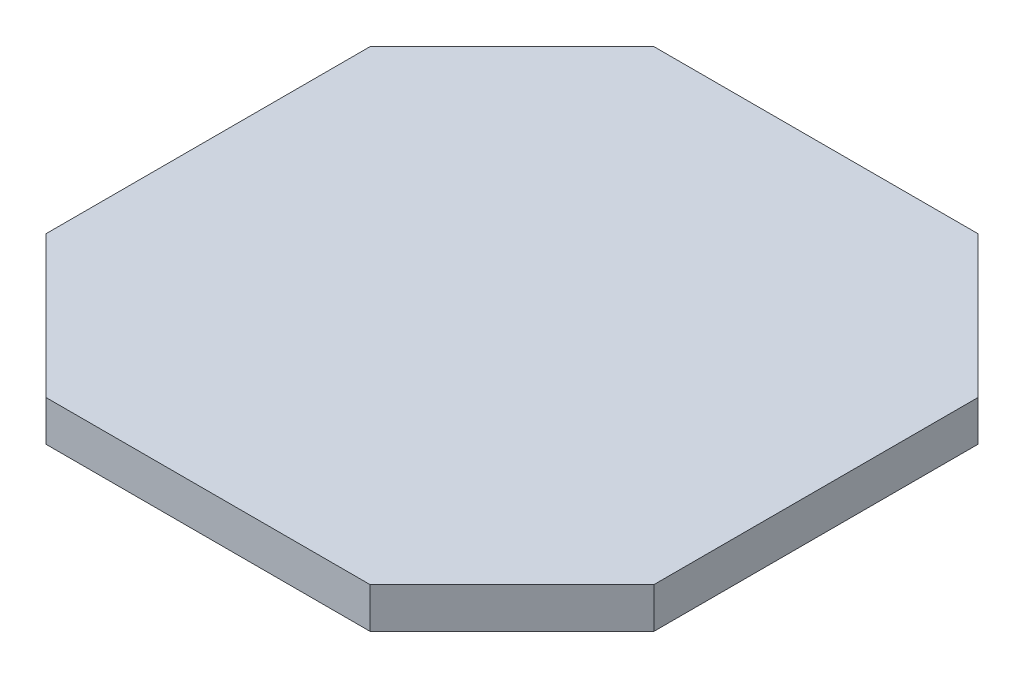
SolidWorks part; units mm, degrees
ref_plane "Front Plane" through (0, 0, 0) normal (0, 0, 1) x (1, 0, 0)
ref_plane "Top Plane" through (0, 0, 0) normal (0, 1, 0) x (1, 0, 0)
ref_plane "Right Plane" through (0, 0, 0) normal (1, 0, 0) x (0, 0, -1)
sketch "Sketch1" plane through (0, 0, 0) normal (0, 1, 0) x (1, 0, 0)
  line L0 (0, 0) -> (0, 19.05) construction
  line L1 (10.16, -19.05) -> (19.05, -10.16)
  line L2 (19.05, 0) -> (19.05, -10.16)
  line L3 (10.16, 19.05) -> (19.05, 10.16)
  line L4 (-19.05, 0) -> (-19.05, 10.16)
  line L5 (10.16, 19.05) -> (-10.16, 19.05)
  line L6 (-10.16, 19.05) -> (-19.05, 10.16)
  line L7 (-19.05, 0) -> (-19.05, -10.16)
  line L8 (10.16, -19.05) -> (-10.16, -19.05)
  line L9 (-10.16, -19.05) -> (-19.05, -10.16)
  line L10 (19.05, 0) -> (19.05, 10.16)
  point P12 (0, -19.05)
extrude "Extrude1" add sketch "Sketch1" along normal blind 2.54
